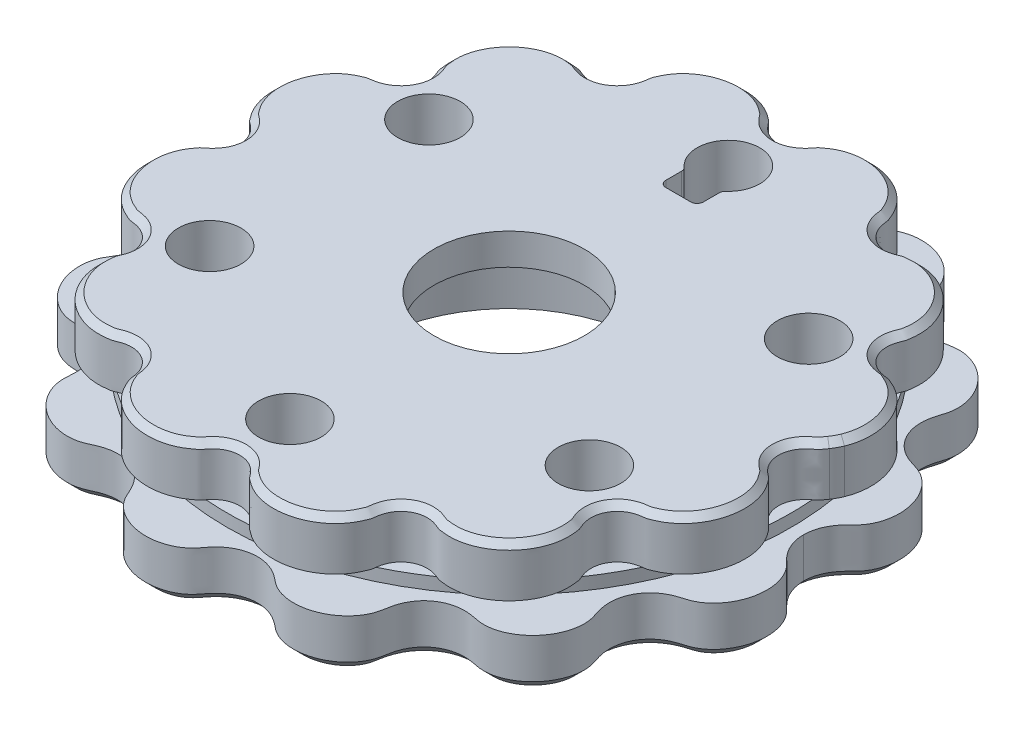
SolidWorks part; units mm, degrees
ref_plane "Front Plane" through (0, 0, 0) normal (0, 0, 1) x (1, 0, 0)
ref_plane "Top Plane" through (0, 0, 0) normal (0, 1, 0) x (1, 0, 0)
ref_plane "Right Plane" through (0, 0, 0) normal (1, 0, 0) x (0, 0, -1)
sketch "Sketch2" plane through (0, 0, 0) normal (0, 1, 0) x (1, 0, 0)
  line L0 (-44.0456, 0) -> (44.0456, 0) construction
  spline S0 degree 4 number of poles 330 (2.5323, 23.3798) -> (-4.4539, 25.9592) construction
  spline S1 degree 4 number of poles 146 (23.5, 0) -> (-26.5, 0)
  spline S2 degree 4 number of poles 146 (23.5, 0) -> (-26.5, 0)
  point P7 (0, 0)
extrude "Boss-Extrude1" add sketch "Sketch2" along normal blind 4
sketch "Sketch10" plane through (0, 4, 0) normal (0, 1, 0) x (1, 0, 0)
  circle A0 centre (1.5, 0) radius 28 construction
  circle A1 centre (29.5, 0) radius 3
  circle A2 centre (26.7271, -12.1487) radius 3
  circle A3 centre (18.9577, -21.8913) radius 3
  circle A4 centre (7.7306, -27.298) radius 3
  circle A5 centre (-4.7306, -27.298) radius 3
  circle A6 centre (-15.9577, -21.8913) radius 3
  circle A7 centre (-23.7271, -12.1487) radius 3
  circle A8 centre (-26.5, 0) radius 3
  circle A9 centre (-23.7271, 12.1487) radius 3
  circle A10 centre (-15.9577, 21.8913) radius 3
  circle A11 centre (-4.7306, 27.298) radius 3
  circle A12 centre (7.7306, 27.298) radius 3
  circle A13 centre (18.9577, 21.8913) radius 3
  circle A14 centre (26.7271, 12.1487) radius 3
  arc A15 (28.5033, 9.731) -> (30.0512, 2.9489) centre (30.7478, 6.6756) ccw
  circle A16 centre (1.5, 0) radius 30 construction
  arc A17 (30.0512, -2.9489) -> (28.5033, -9.731) centre (30.7478, -6.6756) ccw
  arc A18 (25.9443, -15.0448) -> (21.607, -20.4836) centre (24.9549, -18.7047) ccw
  arc A19 (16.9958, -24.1609) -> (10.7282, -27.1792) centre (14.5165, -27.0291) ccw
  arc A20 (4.9783, -28.4916) -> (-1.9783, -28.4916) centre (1.5, -30) ccw
  arc A21 (-7.7282, -27.1792) -> (-13.9958, -24.1609) centre (-11.5165, -27.0291) ccw
  arc A22 (-18.607, -20.4836) -> (-22.9443, -15.0448) centre (-21.9549, -18.7047) ccw
  arc A23 (-25.5033, -9.731) -> (-27.0512, -2.9489) centre (-27.7478, -6.6756) ccw
  arc A24 (-27.0512, 2.9489) -> (-25.5033, 9.731) centre (-27.7478, 6.6756) ccw
  arc A25 (-22.9443, 15.0448) -> (-18.607, 20.4836) centre (-21.9549, 18.7047) ccw
  arc A26 (-13.9958, 24.1609) -> (-7.7282, 27.1792) centre (-11.5165, 27.0291) ccw
  arc A27 (-1.9783, 28.4916) -> (4.9783, 28.4916) centre (1.5, 30) ccw
  arc A28 (10.7282, 27.1792) -> (16.9958, 24.1609) centre (14.5165, 27.0291) ccw
  arc A29 (21.607, 20.4836) -> (25.9443, 15.0448) centre (24.9549, 18.7047) ccw
  point P76 (1.5, 0)
  point P78 (1.5, 0)
sketch "Sketch17" plane through (0, 4, 0) normal (0, 1, 0) x (1, 0, 0)
  circle A0 centre (0, 0) radius 22.5
  dimension "D1" = 45
extrude "Boss-Extrude6" add sketch "Sketch17" along normal blind 1
sketch "Sketch5" [suppressed] plane through (0, 6.1, 0) normal (0, -1, 0) x (-1, 0, 0)
  circle A0 centre (0, 0) radius 6.5
  circle A1 centre (0, 0) radius 5 construction
  dimension "D2" = 13
  dimension "D3" = 10
extrude "Cut-Extrude2" [suppressed] cut sketch "Sketch5" against normal through all
chamfer "Chamfer4" distance 0.8 angle 45 1 edges
sketch "Sketch12" [suppressed] plane through (0, 8.5, 0) normal (0, 1, 0) x (1, 0, 0)
  line L0 (0, 0) -> (25, 0) construction
  circle A0 centre (0, 0) radius 25 construction
  circle A1 centre (25, 0) radius 3
  circle A2 centre (22.5242, -10.8471) radius 3
  circle A3 centre (15.5872, -19.5458) radius 3
  circle A4 centre (5.563, -24.3732) radius 3
  circle A5 centre (-5.563, -24.3732) radius 3
  circle A6 centre (-15.5872, -19.5458) radius 3
  circle A7 centre (-22.5242, -10.8471) radius 3
  circle A8 centre (-25, 0) radius 3
  circle A9 centre (-22.5242, 10.8471) radius 3
  circle A10 centre (-15.5872, 19.5458) radius 3
  circle A11 centre (-5.563, 24.3732) radius 3
  circle A12 centre (5.563, 24.3732) radius 3
  circle A13 centre (15.5872, 19.5458) radius 3
  circle A14 centre (22.5242, 10.8471) radius 3
sketch "Sketch13" plane through (0, 5, 0) normal (0, 1, 0) x (1, 0, 0)
  line L0 (38.8526, 0) -> (-43.8734, 0.6224) construction
  arc A1 (23.4997, 3.2644) -> (23.0719, 2.4768) centre (19.6363, 4.8531) cw
  spline S0 degree 4 number of poles 584 (18.6972, 13.243) -> (22.7386, -8.1797) construction
  spline S1 degree 4 number of poles 495 (23.0719, 2.4768) -> (23.4997, 3.2644)
extrude "Boss-Extrude3" add sketch "Sketch13" along normal blind 4 contours S1 A1
sketch "Sketch14" plane through (0, 0, 0) normal (0, -1, 0) x (1, 0, 0)
  circle A0 centre (0, 0) radius 17.5 construction
  circle A1 centre (0, 17.5) radius 2.5
  circle A2 centre (15.1554, 8.75) radius 2.5
  circle A3 centre (15.1554, -8.75) radius 2.5
  circle A4 centre (0, -17.5) radius 2.5
  circle A5 centre (-15.1554, -8.75) radius 2.5
  circle A6 centre (-15.1554, 8.75) radius 2.5
  dimension "D1" = 5
  dimension "D2" = 35
  dimension "D3" = 6
extrude "Cut-Extrude3" cut sketch "Sketch14" against normal through all
sketch "Sketch15" plane through (0, 9, 0) normal (0, 1, 0) x (1, 0, 0)
  circle A0 centre (0, 0) radius 22.4967 construction
  circle A1 centre (0, 22.4967) radius 1.9073
  circle A2 centre (11.2484, 19.4827) radius 1.9073
  circle A3 centre (19.4827, 11.2484) radius 1.9073
  circle A4 centre (22.4967, 0) radius 1.9073
  circle A5 centre (19.4827, -11.2484) radius 1.9073
  circle A6 centre (11.2484, -19.4827) radius 1.9073
  circle A7 centre (0, -22.4967) radius 1.9073
  circle A8 centre (-11.2484, -19.4827) radius 1.9073
  circle A9 centre (-19.4827, -11.2484) radius 1.9073
  circle A10 centre (-22.4967, 0) radius 1.9073
  circle A11 centre (-19.4827, 11.2484) radius 1.9073
  circle A12 centre (-11.2484, 19.4827) radius 1.9073
  dimension "D1" = 0
  dimension "D2" = 12
sketch "Sketch16" plane through (0, 0, 0) normal (0, -1, 0) x (1, 0, 0)
  circle A0 centre (0, 0) radius 23.3005 construction
  circle A1 centre (-23.3005, 0) radius 2.5
  circle A2 centre (-20.6316, 10.8283) radius 2.5
  circle A3 centre (-13.2362, 19.1759) radius 2.5
  circle A4 centre (-2.8086, 23.1306) radius 2.5
  circle A5 centre (8.2625, 21.7863) radius 2.5
  circle A6 centre (17.4407, 15.4511) radius 2.5
  circle A7 centre (22.6234, 5.5762) radius 2.5
  circle A8 centre (22.6234, -5.5762) radius 2.5
  circle A9 centre (17.4407, -15.4511) radius 2.5
  circle A10 centre (8.2625, -21.7863) radius 2.5
  circle A11 centre (-2.8086, -23.1306) radius 2.5
  circle A12 centre (-13.2362, -19.1759) radius 2.5
  circle A13 centre (-20.6316, -10.8283) radius 2.5
  dimension "D1" = 5
  dimension "D2" = 13
chamfer "Chamfer5" distance 0.5 angle 45 2 edges at (23.307, 9, -2.8591)
sketch "Sketch18" plane through (0, 0, 0) normal (0, 1, 0) x (1, 0, 0)
  circle A0 centre (0, 0) radius 11.15
  dimension "D1" = 22.3
extrude "Cut-Extrude4" cut sketch "Sketch18" along normal blind 6.5
sketch "Sketch19" plane through (0, 0, 0) normal (0, -1, 0) x (1, 0, 0)
  circle A0 centre (0, 0) radius 6
  dimension "D1" = 12
extrude "Cut-Extrude5" cut sketch "Sketch19" against normal through all
sketch "Sketch20" plane through (0, 9, 0) normal (0, 1, 0) x (1, 0, 0)
  line L0 (0, 15) -> (0, 17.5) construction
  line L1 (-1.5, 16.5) -> (1.5, 16.5)
  line L2 (-1.5, 16.5) -> (-1.5, 13.5)
  line L3 (-1.5, 13.5) -> (1.5, 13.5)
  line L4 (1.5, 16.5) -> (1.5, 13.5)
  line L5 (-1.5, 16.5) -> (1.5, 13.5) construction
  line L6 (-1.5, 13.5) -> (1.5, 16.5) construction
  circle A0 centre (0, 17.5) radius 2.5 construction
  point P0 (0, 15)
  dimension "D1" = 3
  dimension "D2" = 1.5
extrude "Cut-Extrude6" cut sketch "Sketch20" against normal through all
fillet "Fillet1" radius 0.5 4 edges at (-1.5, 4.5, -15.5) (-1.5, 4.5, -13.5) (1.5, 4.5, -13.5) (1.5, 4.5, -15.5)
split "Split1" bodies to split 112 resulting bodies 113 114
equation "\"N\"= 14"
equation "\"Rr\"= 3"
equation "\"R\"= 28"
equation "\"E\"= 1.5"
equation "\"D2@Sketch10\"=\"Rr\" *2"
equation "\"D1@Sketch10\"= \"R\" *2"
equation "\"D3@Sketch10\"=\"N\""
equation "\"D5@Sketch10\"=\"N\""
equation "\"D6@Sketch10\"=-\"E\""
equation "\"D1@Sketch12\"=(\"R\" - \"Rr\" ) *2"
equation "\"D2@Sketch12\"=\"Rr\" * 2"
equation "\"D3@Sketch12\"=\"N\""
equation "\"D3@Sketch1\"=\"N\""
